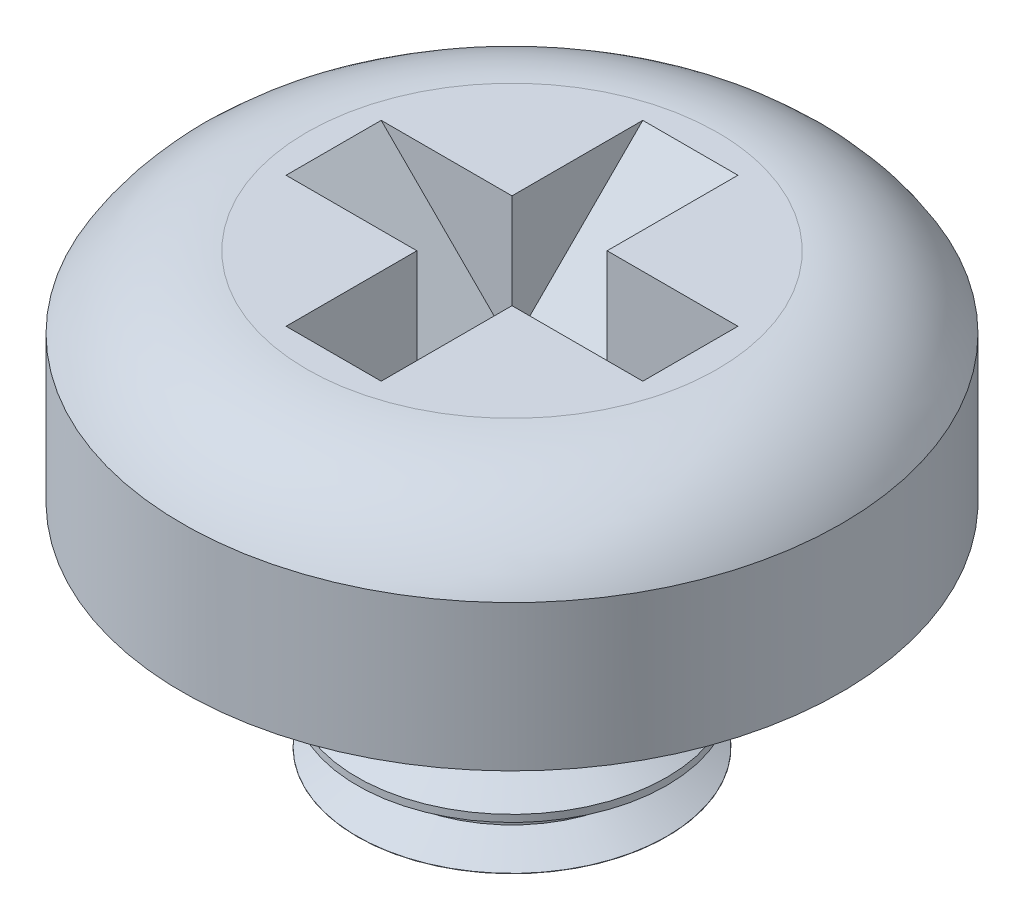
SolidWorks part; units mm, degrees
ref_plane "Front" through (0, 0, 0) normal (0, 0, 1) x (1, 0, 0)
ref_plane "Top" through (0, 0, 0) normal (0, 1, 0) x (1, 0, 0)
ref_plane "Right" through (0, 0, 0) normal (1, 0, 0) x (0, 0, -1)
imported_body "Imported1"
sketch "Sketch1" plane through (0, 145.5789, 0) normal (0, -1, 0) x (1, 0, 0)
  circle A0 centre (0, 0) radius 5.1797
sketch "Sketch2" plane through (0, 135.9269, 0) normal (0, -1, 0) x (1, 0, 0)
  circle A0 centre (0, 0) radius 4.0181
extrude "Cut-Extrude1" cut sketch "Sketch2" against normal blind 6.35
